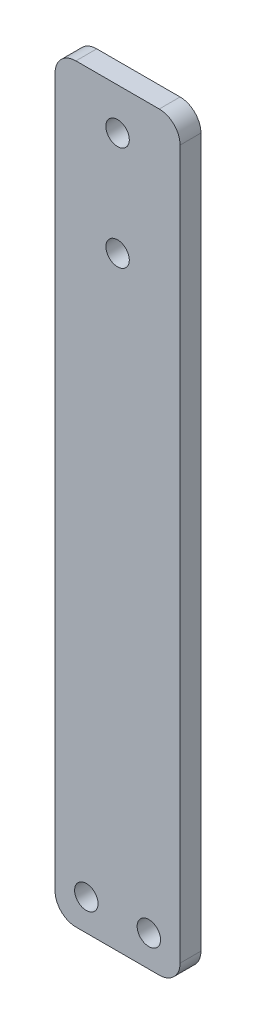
SolidWorks part; units mm, degrees
ref_plane "Front Plane" through (0, 0, 0) normal (0, 0, 1) x (1, 0, 0)
ref_plane "Top Plane" through (0, 0, 0) normal (0, 1, 0) x (1, 0, 0)
ref_plane "Right Plane" through (0, 0, 0) normal (1, 0, 0) x (0, 0, -1)
sketch "Sketch1" plane through (0, 0, 0) normal (0, 0, 1) x (1, 0, 0)
  line L1 (-19.05, -114.3) -> (19.05, -114.3)
  line L2 (-19.05, -114.3) -> (-19.05, 114.3)
  line L3 (-19.05, 114.3) -> (19.05, 114.3)
  line L4 (19.05, -114.3) -> (19.05, 114.3)
  line L5 (-19.05, -114.3) -> (19.05, 114.3) construction
  line L6 (-19.05, 114.3) -> (19.05, -114.3) construction
  circle A0 centre (0, 101.6) radius 3.5719
  circle A1 centre (0, 69.85) radius 3.5719
  point P0 (0, 0)
  point P8 (0, 114.3)
  point P11 (0, 0)
  dimension "D3" = 7.1437
  dimension "D5" = 31.75
  dimension "D6" = 7.1437
  dimension "D1" = 38.1
  dimension "D2" = 228.6
  dimension "D4" = 12.7
extrude "Boss-Extrude1" add sketch "Sketch1" along normal blind 6.35
fillet "Fillet1" radius 6.35 4 edges at (-19.05, -114.3, 3.175) (19.05, -114.3, 3.175) (19.05, 114.3, 3.175) (-19.05, 114.3, 3.175)
sketch "Sketch2" plane through (0, 0, 6.35) normal (0, 0, 1) x (1, 0, 0)
  line L0 (-19.05, 107.95) -> (-19.05, -107.95) construction
  line L1 (19.05, -107.95) -> (19.05, 107.95) construction
  line L2 (-12.7, -114.3) -> (12.7, -114.3) construction
  circle A0 centre (-9.525, -104.775) radius 3.5719
  circle A1 centre (9.525, -104.775) radius 3.5719
  dimension "D2" = 9.525
  dimension "D3" = 9.525
  dimension "D4" = 7.1437
  dimension "D5" = 7.1437
  dimension "D1" = 9.525
extrude "Cut-Extrude1" cut sketch "Sketch2" against normal through all
